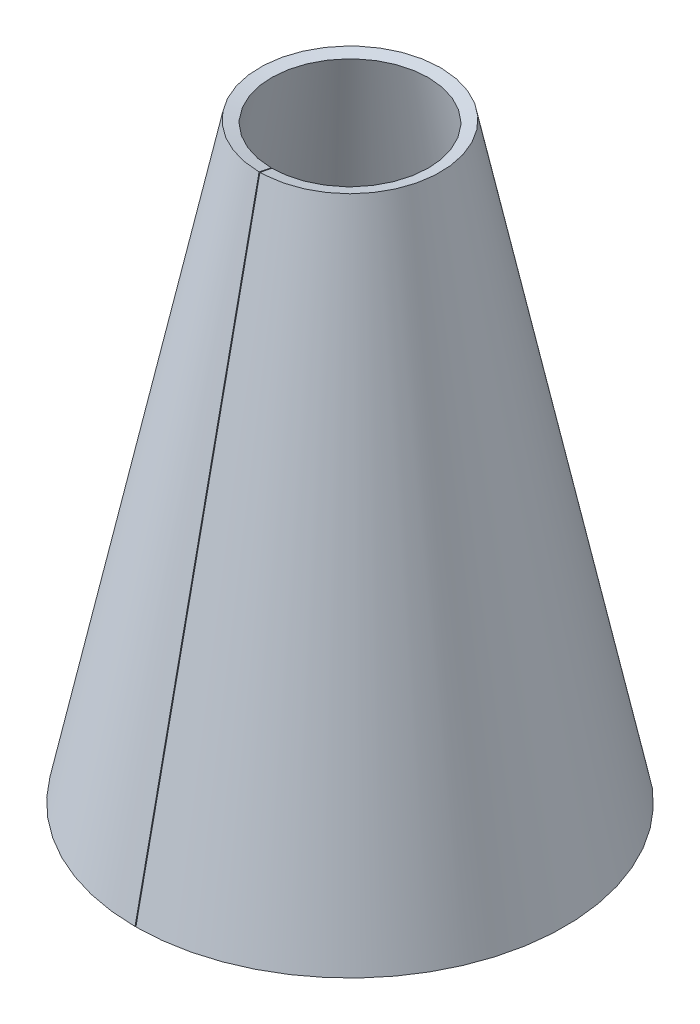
SolidWorks part; units mm, degrees
ref_plane "前视基准面" through (0, 0, 0) normal (0, 0, 1) x (1, 0, 0)
ref_plane "上视基准面" through (0, 0, 0) normal (0, 1, 0) x (1, 0, 0)
ref_plane "右视基准面" through (0, 0, 0) normal (1, 0, 0) x (0, 0, -1)
sketch "草图1" plane through (0, 0, 0) normal (0, 1, 0) x (1, 0, 0)
  line L0 (0.5, 0) -> (0.5, -242.9995) construction
  line L1 (-0.5, 0) -> (0.5, 0) construction
  line L2 (-0.5, 0) -> (-0.5, -242.9995) construction
  arc A0 (0.5, -242.9995) -> (-0.5, -242.9995) centre (0, 0) ccw
  dimension "D1" = 1
  dimension "dm" = 486
ref_plane "基准面1" through (0, 670, 0) normal (0, 1, 0) x (-1, 0, 0)
sketch "草图2" plane through (0, 670, 0) normal (0, 1, 0) x (-1, 0, 0)
  line L0 (-0.5, 0) -> (0.5, 0) construction
  line L1 (-0.5, 0) -> (-0.5, 102.4988) construction
  line L2 (0.5, 0) -> (0.5, 102.4988) construction
  arc A0 (-0.5, 102.4988) -> (0.5, 102.4988) centre (0, 0) ccw
  dimension "D1" = 1
  dimension "d" = 205
sheet metal parameters "钣金1" thickness 14 parameters "D1"=0.7366, "厚度"=14
lofted bend "放样折弯1" thickness 14 parameters "D1"=0, "t"=14, "D12"=1
other "自由形折弯1" parameters "D1"=1000, "D4"=57.296, "D5"=1
flat pattern "平板型式1"
sketch "折弯-线1" plane through (-0.6736, 48.811, 232.7632) normal (0.0028, -0.2052, -0.9787) x (-1, -0.0006, -0.0028)
  line L0 (-0.1736, 634.7004) -> (-0.1736, -49.8728) construction
  line L1 (511.6683, 1019.3991) -> (1169.3419, 829.3837) construction
other "展开-<自由形折弯1>1"
